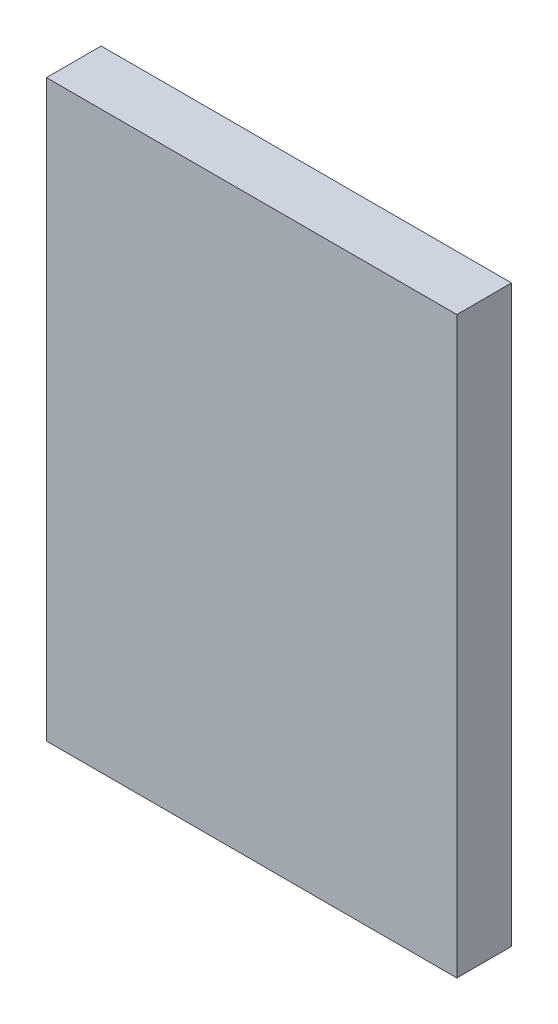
SolidWorks part; units mm, degrees
ref_plane "前视基准面" through (0, 0, 0) normal (0, 0, 1) x (1, 0, 0)
ref_plane "上视基准面" through (0, 0, 0) normal (0, 1, 0) x (1, 0, 0)
ref_plane "右视基准面" through (0, 0, 0) normal (1, 0, 0) x (0, 0, -1)
other "Configuration Table"
sketch "Battery_USER_450mAh_30x42x4_Sketch" plane through (0, 0, 0) normal (0, 0, 1) x (1, 0, 0)
  line L1 (-15, -21) -> (15, -21)
  line L2 (-15, -21) -> (-15, 21)
  line L3 (-15, 21) -> (15, 21)
  line L4 (15, -21) -> (15, 21)
extrude "Battery_USER_450mAh_30x42x4" add sketch "Battery_USER_450mAh_30x42x4_Sketch" along normal blind 4 from offset 5.85
